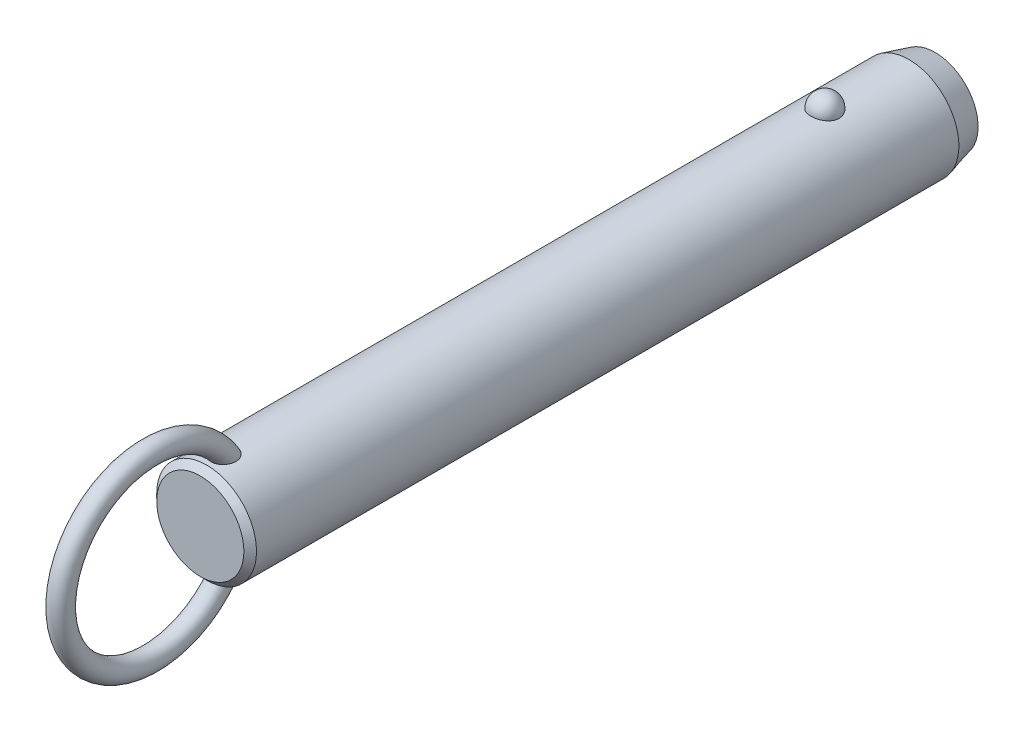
SolidWorks part; units mm, degrees
ref_plane "Front Plane" through (0, 0, 0) normal (0, 0, 1) x (1, 0, 0)
ref_plane "Top Plane" through (0, 0, 0) normal (0, 1, 0) x (1, 0, 0)
ref_plane "Right Plane" through (0, 0, 0) normal (1, 0, 0) x (0, 0, -1)
sketch "Sketch2" plane through (0, 0, 0) normal (0, 0, 1) x (1, 0, 0)
  circle A0 centre (0, 0) radius 9.5
  point P3 (0, 9.5)
  dimension "D1" = 19
extrude "Boss-Extrude1" add sketch "Sketch2" along normal blind 106.7
sketch "Sketch3" plane through (0, 0, 0) normal (0, 0, -1) x (-1, 0, 0)
  circle A0 centre (0, 0) radius 9.5
  dimension "D1" = 19
extrude "Boss-Extrude2" add sketch "Sketch3" along normal blind 23.7
chamfer "Chamfer1" distance 5 angle 15 1 edges at (-9.5, 0, -23.7)
sketch "Sketch12" plane through (0, 0, 0) normal (1, 0, 0) x (0, 0, -1)
  line L0 (-106.7, 9.5) -> (-106.7, -9.5) construction
  point P0 (-106.7, 0)
sketch "Sketch13" plane through (0, 0, 0) normal (1, 0, 0) x (0, 0, -1)
  circle A0 centre (-125.75, 0) radius 19.05
  point P2 (-106.7, 0)
  dimension "D1" = 38.1
sketch "Sketch14" plane through (0, 0, 0) normal (0, 1, 0) x (1, 0, 0)
  circle A0 centre (0, -108.7) radius 2
  point P2 (0, -106.7)
  dimension "D1" = 4
sweep "Sweep1" add profiles "Sketch14" path "Sketch13"
sketch "Sketch15" plane through (0, 0, 106.7) normal (0, 0, 1) x (1, 0, 0)
  circle A0 centre (0, 0) radius 9.5
  dimension "D1" = 19
extrude "Boss-Extrude3" add sketch "Sketch15" along normal blind 9.52
chamfer "Chamfer2" distance 1.2 angle 45 1 edges at (9.5, 0, 116.22)
sketch "Sketch18" plane through (0, 0, 0) normal (1, 0, 0) x (0, 0, -1)
  line L0 (18.7, 9.5) -> (-109.2378, 9.5) construction
  line L1 (2.7, 12.2) -> (2.7, 6.8)
  line L2 (-109.2378, -9.5) -> (18.7, -9.5) construction
  arc A0 (2.7, 12.2) -> (2.7, 6.8) centre (2.7, 9.5) ccw
  point P4 (0, 9.5)
  dimension "D1" = 21.7
revolve "Revolve1" add sketch "Sketch18" angle 360 about L1
